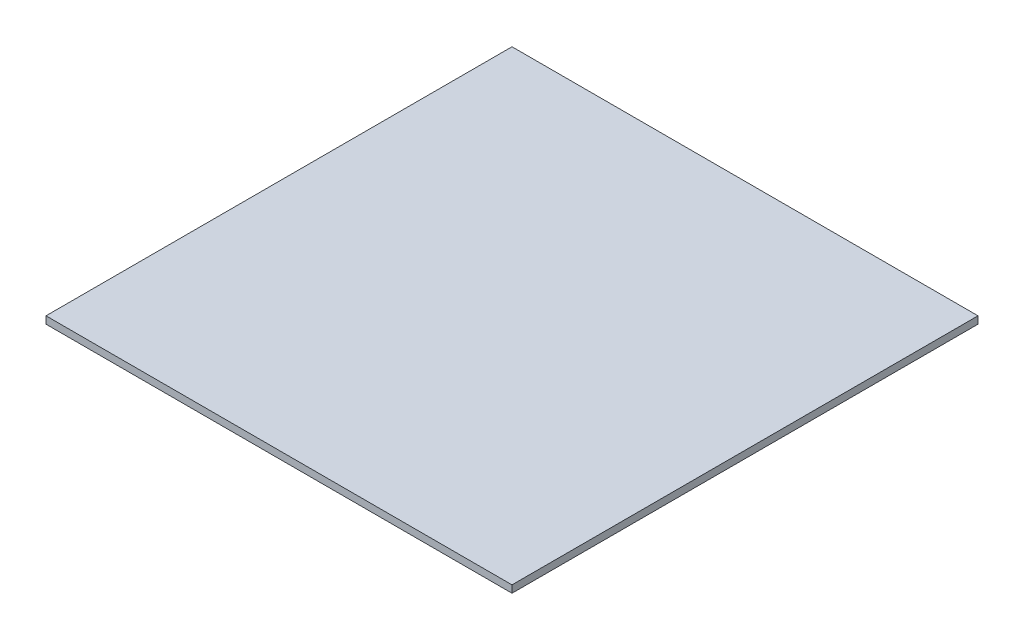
SolidWorks part; units mm, degrees
ref_plane "Front Plane" through (0, 0, 0) normal (0, 0, 1) x (1, 0, 0)
ref_plane "Top Plane" through (0, 0, 0) normal (0, 1, 0) x (1, 0, 0)
ref_plane "Right Plane" through (0, 0, 0) normal (1, 0, 0) x (0, 0, -1)
sketch "Sketch1" plane through (0, 0, 0) normal (0, 1, 0) x (1, 0, 0)
  line L1 (-609.6, -609.6) -> (609.6, -609.6)
  line L2 (-609.6, -609.6) -> (-609.6, 609.6)
  line L3 (-609.6, 609.6) -> (609.6, 609.6)
  line L4 (609.6, -609.6) -> (609.6, 609.6)
extrude "Extrude1" add sketch "Sketch1" along normal blind 19.05
